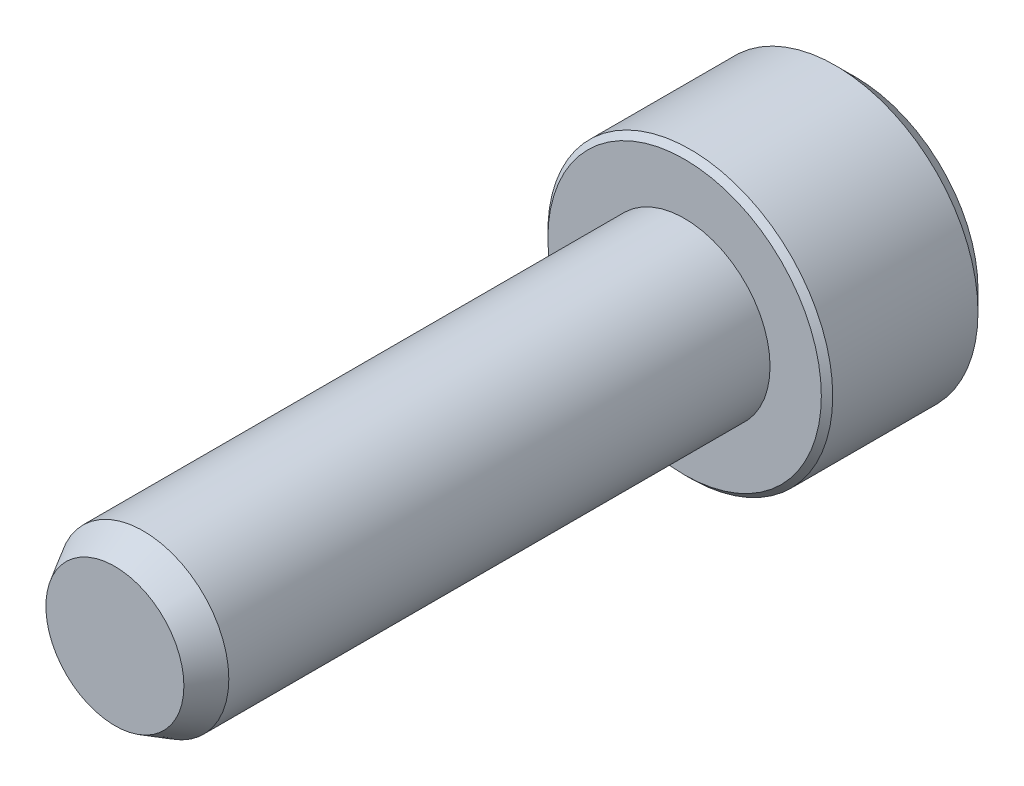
SolidWorks part; units mm, degrees
ref_plane "Plan1" through (0, 0, 0) normal (0, 0, 1) x (1, 0, 0)
ref_plane "Plan2" through (0, 0, 0) normal (0, 1, 0) x (1, 0, 0)
ref_plane "Plan3" through (0, 0, 0) normal (1, 0, 0) x (0, 0, -1)
sketch "Esquisse1" plane through (0, 0, 0) normal (0, 0, 1) x (1, 0, 0)
  circle A0 centre (0, 0) radius 3
  dimension "D1" = 6
extrude "Base-Extrusion" add sketch "Esquisse1" along normal blind 20
sketch "Esquisse2" plane through (0, 0, 0) normal (0, 0, 1) x (1, 0, 0)
  circle A0 centre (0, 0) radius 5
  dimension "D1" = 10
extrude "Boss.-Extru.1" add sketch "Esquisse2" against normal blind 6
ref_plane "Plan4" through (0, 0, -6) normal (0, 0, 1) x (1, 0, 0)
sketch "Esquisse3" plane through (0, 0, -6) normal (0, 0, 1) x (1, 0, 0)
  line L0 (-1.4434, 2.5) -> (1.4434, 2.5)
  line L1 (-1.4434, -2.5) -> (1.4434, -2.5)
  line L2 (-1.4434, 2.5) -> (-2.8868, 0)
  line L3 (1.4434, -2.5) -> (2.8868, 0)
  line L4 (-2.8868, 0) -> (-1.4434, -2.5)
  line L6 (1.4434, 2.5) -> (2.8868, 0)
extrude "Enlèv. mat.-Extru.1" cut sketch "Esquisse3" along normal blind 3
chamfer "Chanfrein1" distance 0.7 angle 45 1 edges at (5, 0, -6)
chamfer "Chanfrein2" distance 1 angle 30 1 edges at (3, 0, 20)
chamfer "Chanfrein3" distance 0.2 angle 45 1 edges at (5, 0, 0)
